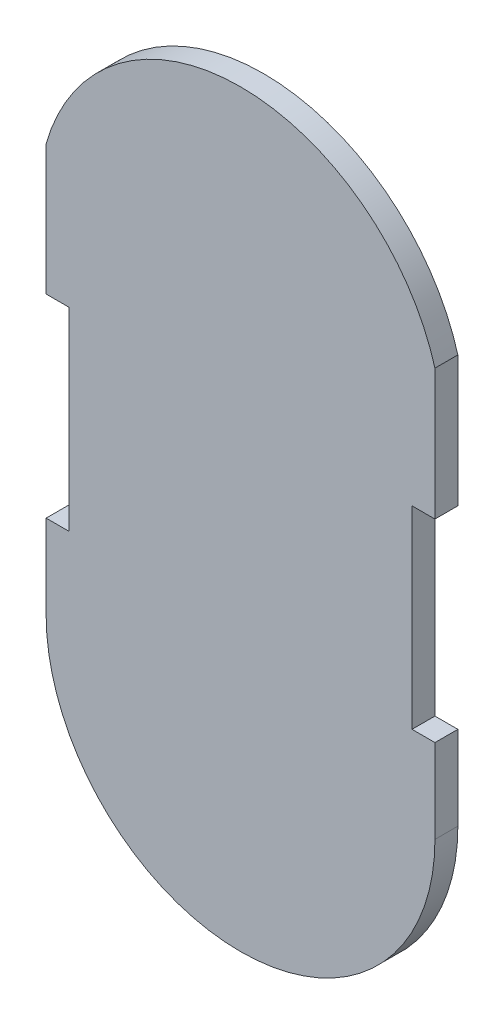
SolidWorks part; units mm, degrees
ref_plane "Front Plane" through (0, 0, 0) normal (0, 0, 1) x (1, 0, 0)
ref_plane "Top Plane" through (0, 0, 0) normal (0, 1, 0) x (1, 0, 0)
ref_plane "Right Plane" through (0, 0, 0) normal (1, 0, 0) x (0, 0, -1)
sketch "Sketch1" plane through (0, 0, 0) normal (0, 0, 1) x (1, 0, 0)
  line L0 (13.1287, 8.7099) -> (13.1287, -42.0901) construction
  line L1 (0.206, -36.5181) -> (0.206, -42.0901)
  line L2 (26.0515, -14.9628) -> (26.0515, -23.6504)
  line L3 (0.206, -14.9628) -> (0.206, -23.6212)
  line L4 (26.0515, -23.6504) -> (24.5275, -23.6504)
  line L6 (26.0515, -36.5154) -> (24.5275, -36.5154)
  line L7 (24.5275, -23.6504) -> (24.5275, -36.5154)
  line L8 (1.7253, -36.5181) -> (0.206, -36.5181)
  line L9 (1.7253, -36.5181) -> (1.7253, -23.6212)
  line L10 (1.7253, -23.6212) -> (0.206, -23.6212)
  line L11 (26.0515, -36.5154) -> (26.0515, -42.0901)
  arc A1 (0.206, -42.0901) -> (26.0515, -42.0901) centre (13.1287, -42.0901) ccw
  arc A2 (0.206, -14.9628) -> (26.0515, -14.9628) centre (13.1287, -18.6692) cw
  point P4 (13.1287, -16.6901)
extrude "Boss-Extrude1" add sketch "Sketch1" along normal blind 1.524
